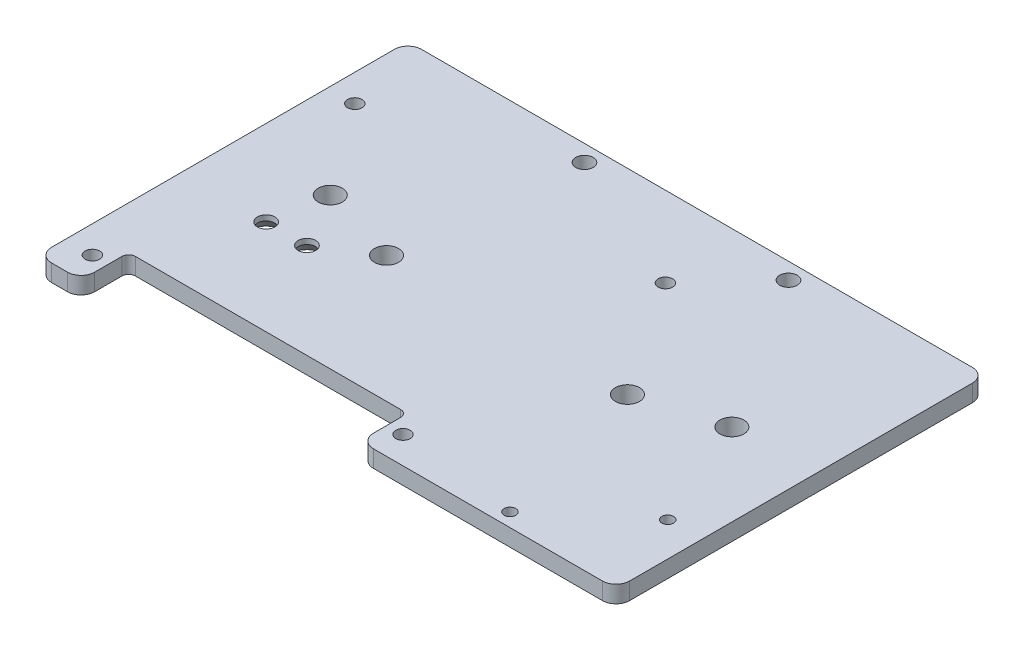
SolidWorks part; units mm, degrees
ref_plane "Front Plane" through (0, 0, 0) normal (0, 0, 1) x (1, 0, 0)
ref_plane "Top Plane" through (0, 0, 0) normal (0, 1, 0) x (1, 0, 0)
ref_plane "Right Plane" through (0, 0, 0) normal (1, 0, 0) x (0, 0, -1)
sketch "Sketch1" plane through (0, 0, 0) normal (0, 1, 0) x (1, 0, 0)
  line L1 (0, 0) -> (107.95, 0)
  line L2 (0, 0) -> (0, 69.088)
  line L3 (0, 69.088) -> (107.95, 69.088)
  line L4 (107.95, 0) -> (107.95, 69.088)
  dimension "D1" = 107.95
  dimension "D2" = 69.088
extrude "Boss-Extrude1" add sketch "Sketch1" along normal blind 3.175
sketch "Sketch2" plane through (0, 0, 0) normal (0, -1, 0) x (1, 0, 0)
  line L0 (107.95, -66.0135) -> (74.1363, -66.0135) construction
  line L1 (107.95, 0) -> (107.95, -69.088) construction
  line L2 (74.1363, -66.0135) -> (36.0363, -66.0135) construction
  line L3 (107.95, -69.088) -> (0, -69.088) construction
  line L4 (5.08, -5.08) -> (8.045, -5.08) construction
  line L5 (0, -69.088) -> (0, 0) construction
  line L6 (5.08, -5.08) -> (63.08, -5.08) construction
  line L7 (5.08, -5.08) -> (5.08, -54.08) construction
  line L8 (5.08, -54.08) -> (63.08, -54.08) construction
  line L9 (63.08, -5.08) -> (63.08, -54.08) construction
  line L10 (0, 0) -> (107.95, 0) construction
  line L11 (77.5863, -32.49) -> (32.5863, -32.49) construction
  line L12 (101.6, -16.002) -> (101.6, -2.54) construction
  line L13 (101.6, -2.54) -> (85.598, -2.54) construction
  line L14 (8.045, 0) -> (60.115, 0)
  line L15 (8.045, 0) -> (8.045, -8.89)
  line L16 (8.045, -8.89) -> (60.115, -8.89)
  line L17 (60.115, 0) -> (60.115, -8.89)
  line L18 (63.08, -5.08) -> (60.115, -5.08) construction
  circle A0 centre (36.0363, -66.0135) radius 1.6319
  circle A1 centre (74.1363, -66.0135) radius 1.632
  circle A2 centre (5.08, -5.08) radius 1.35
  circle A3 centre (63.08, -5.08) radius 1.35
  circle A4 centre (63.08, -54.08) radius 1.35
  circle A5 centre (5.08, -54.08) radius 1.35
  circle A6 centre (77.5863, -32.49) radius 2.25
  circle A7 centre (32.5863, -32.49) radius 2.25
  circle A8 centre (15.9323, -26.67) radius 0.635
  circle A9 centre (23.5523, -26.67) radius 0.635
  circle A10 centre (101.6, -16.002) radius 1.09
  circle A11 centre (85.598, -2.54) radius 1.09
  point P25 (55.0863, -32.49)
  point P31 (55.0863, -66.0135)
  dimension "D4" = 49
  dimension "D8" = 2.7
  dimension "D9" = 3.2639
  dimension "D11" = 4.5
  dimension "D17" = 1.27
  dimension "D21" = 2.18
  dimension "D19" = 2.54
  dimension "D2" = 38.1
  dimension "D3" = 3.0745
  dimension "D5" = 58
  dimension "D6" = 5.08
  dimension "D7" = 5.08
  dimension "D10" = 45
  dimension "D12" = 32.49
  dimension "D13" = 13.462
  dimension "D14" = 7.62
  dimension "D15" = 26.67
  dimension "D16" = 15.9323
  dimension "D18" = 16.002
  dimension "D20" = 6.35
  dimension "D22" = 2.965
  dimension "D23" = 8.89
  dimension "D24" = 32.5863
extrude "Cut-Extrude1" cut sketch "Sketch2" against normal through all
fillet "Fillet1" radius 2.54 1 edges at (0, 1.5875, 0)
fillet "Fillet2" radius 2.54 1 edges at (0, 1.5875, -69.088)
fillet "Fillet3" radius 2.54 1 edges at (107.95, 1.5875, -69.088)
fillet "Fillet4" radius 2.54 1 edges at (107.95, 1.5875, 0)
fillet "Fillet5" radius 2.54 1 edges at (60.115, 1.5875, 0)
fillet "Fillet12" radius 1.27 1 edges at (60.115, 1.5875, -8.89)
fillet "Fillet11" radius 1.27 1 edges at (8.045, 1.5875, -8.89)
fillet "Fillet8" radius 2.54 1 edges at (8.045, 1.5875, 0)
hole_wizard "CSK for #4 Flat Head Machine Screw1" positions "Sketch3" profile "Sketch4" countersink size "#4" standard "ANSI Inch"
sketch "Sketch3" plane through (0, 0, 0) normal (0, -1, 0) x (-1, 0, 0)
  point P0 (-23.5523, 26.67)
  point P3 (-15.9323, 26.67)
sketch "Sketch4" plane through (23.5523, 0, -26.67) normal (1, 0, 0) x (0, 0, -1)
  line L0 (0, 0) -> (0, 3.175)
  line L1 (0, 3.175) -> (1.6319, 3.175)
  line L2 (1.6319, 3.175) -> (1.6319, 2.1718)
  line L3 (1.6319, 2.1718) -> (3.5199, 0)
  line L5 (3.5199, 0) -> (0, 0)
  line L6 (-1.632, 2.1718) -> (-3.5199, 0) construction
  line L11 (0, -6.35) -> (0, 107.95) construction
  dimension "Thru Hole Dia." = 3.2639
  dimension "Thru Hole Depth" = 3.175
  dimension "Near C'Sink Dia." = 7.0398
  dimension "Near C'Sink Angle" = 82
hole_wizard "M4 Clearance Hole1" positions "Sketch5" profile "Sketch6" hole size "M4" standard "ANSI Metric"
sketch "Sketch5" plane through (0, 0, 0) normal (0, -1, 0) x (-1, 0, 0)
  line L0 (-107.95, 2.54) -> (-107.95, 66.548) construction
  line L1 (-62.655, 0) -> (-105.41, 0) construction
  point P0 (-92.5863, 36.991)
  point P2 (-17.5863, 36.991)
  dimension "D1" = 75
  dimension "D2" = 15.3637
  dimension "D3" = 36.991
sketch "Sketch6" plane through (92.5863, 0, -36.991) normal (1, 0, 0) x (0, 0, -1)
  line L0 (0, 0) -> (0, 3.175)
  line L1 (0, 3.175) -> (2.25, 3.175)
  line L2 (2.25, 3.175) -> (2.25, 0)
  line L5 (2.25, 0) -> (0, 0)
  line L11 (0, -6.35) -> (0, 107.95) construction
  dimension "Thru Hole Dia." = 4.5
  dimension "Thru Hole Depth" = 3.175
